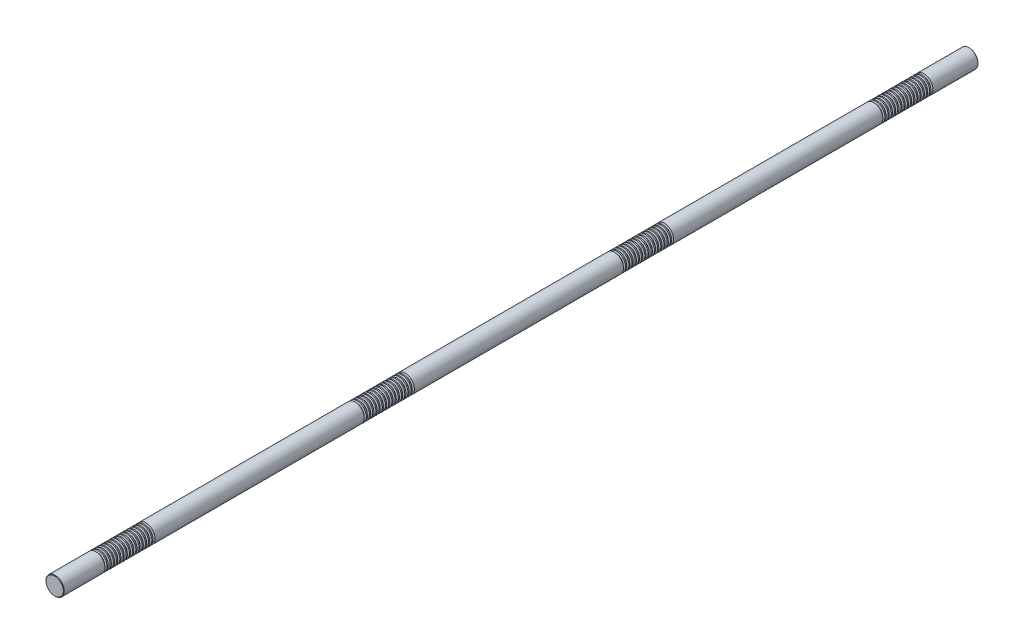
SolidWorks part; units mm, degrees
ref_plane "Front Plane" through (0, 0, 0) normal (0, 0, 1) x (1, 0, 0)
ref_plane "Top Plane" through (0, 0, 0) normal (0, 1, 0) x (1, 0, 0)
ref_plane "Right Plane" through (0, 0, 0) normal (1, 0, 0) x (0, 0, -1)
sketch "Sketch1" plane through (0, 0, 0) normal (0, 0, 1) x (1, 0, 0)
  circle A0 centre (0, 0) radius 20
  dimension "D1" = 40
extrude "Boss-Extrude1" add sketch "Sketch1" along normal mid plane 2000
chamfer "Chamfer1" distance 1 angle 45 2 edges at (20, 0, -1000) (20, 0, 1000)
sketch "Sketch2" plane through (0, 0, 0) normal (1, 0, 0) x (0, 0, -1)
  line L0 (900.5359, 20) -> (895.9641, 20)
  line L1 (999, 20) -> (-999, 20) construction
  line L2 (895.9641, 20) -> (897.0359, 16)
  line L3 (897.0359, 16) -> (899.4641, 16)
  line L4 (899.4641, 16) -> (900.5359, 20)
  line L5 (1000, -19) -> (1000, 19) construction
  point P4 (898.25, 20)
  point P7 (898.25, 16)
  point P8 (900, 18)
  point P9 (896.5, 18)
  dimension "D1" = 3.5
  dimension "D2" = 100
  dimension "D3" = 4
  dimension "D4" = 30
revolve "Cut-Revolve1" cut sketch "Sketch2" angle 360 about axis through (0, 0, 1000) along (0, 0, -1)
pattern_linear "LPattern1" count 16 spacing 7 along (0, 0, 1) of "Cut-Revolve1"
pattern_linear "LPattern2" count 4 spacing 567 along (0, 0, 1) of "Cut-Revolve1", "LPattern1"
